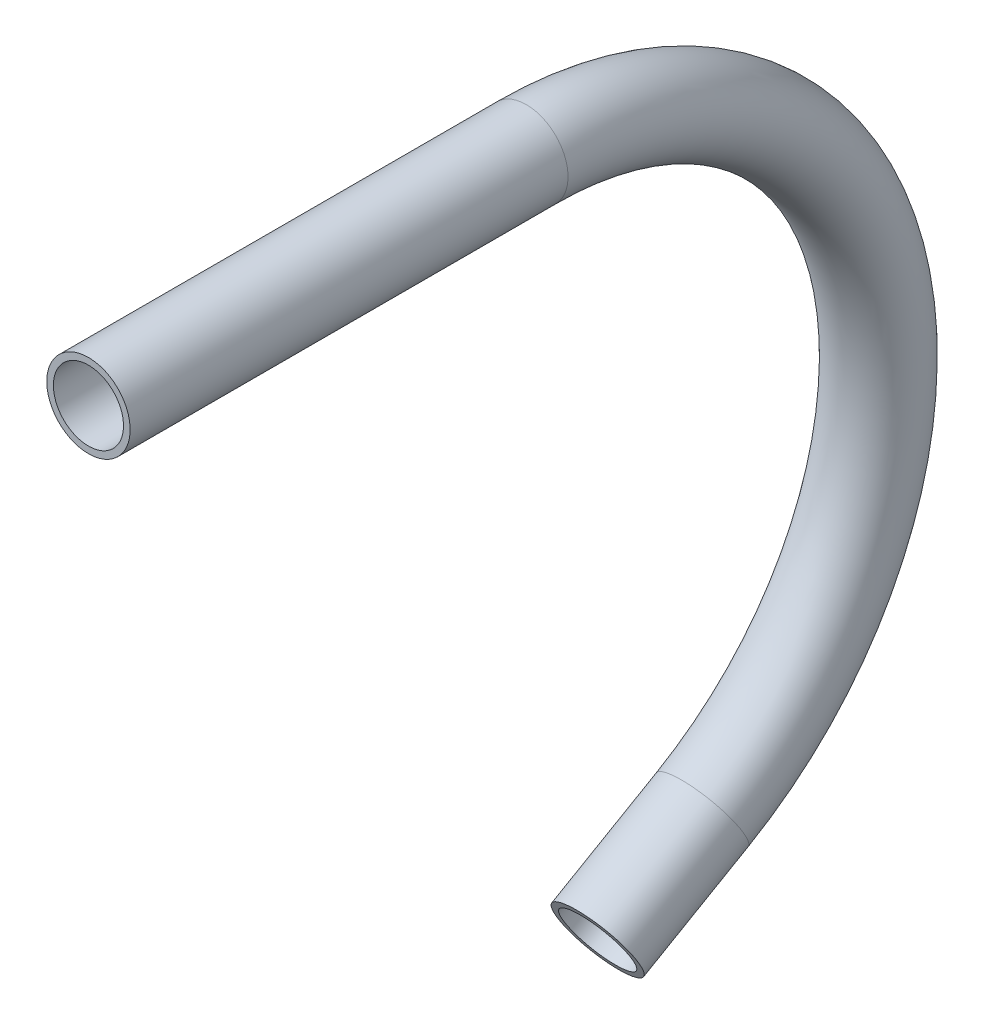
SolidWorks part; units mm, degrees
ref_plane "前视基准面" through (0, 0, 0) normal (0, 0, 1) x (1, 0, 0)
ref_plane "上视基准面" through (0, 0, 0) normal (0, 1, 0) x (1, 0, 0)
ref_plane "右视基准面" through (0, 0, 0) normal (1, 0, 0) x (0, 0, -1)
sketch "草图1" plane through (0, 0, 0) normal (1, 0, 0) x (0, 0, -1)
  line L0 (76, 165) -> (257.129, 165)
  line L1 (76, 147.75) -> (76, 182.25) construction
  line L2 (286.6313, -131.7066) -> (329.9326, -106.7066)
  arc A0 (257.129, 165) -> (329.9326, -106.7066) centre (257.129, 19.3929) cw
  dimension "D1" = 50
sketch "草图2" plane through (0, 0, -76) normal (0, 0, -1) x (-1, 0, 0)
  circle A0 centre (0, 165) radius 17.25
  circle A1 centre (0, 165) radius 14.5
sweep "扫描1" add profiles "草图2" path "草图1"
